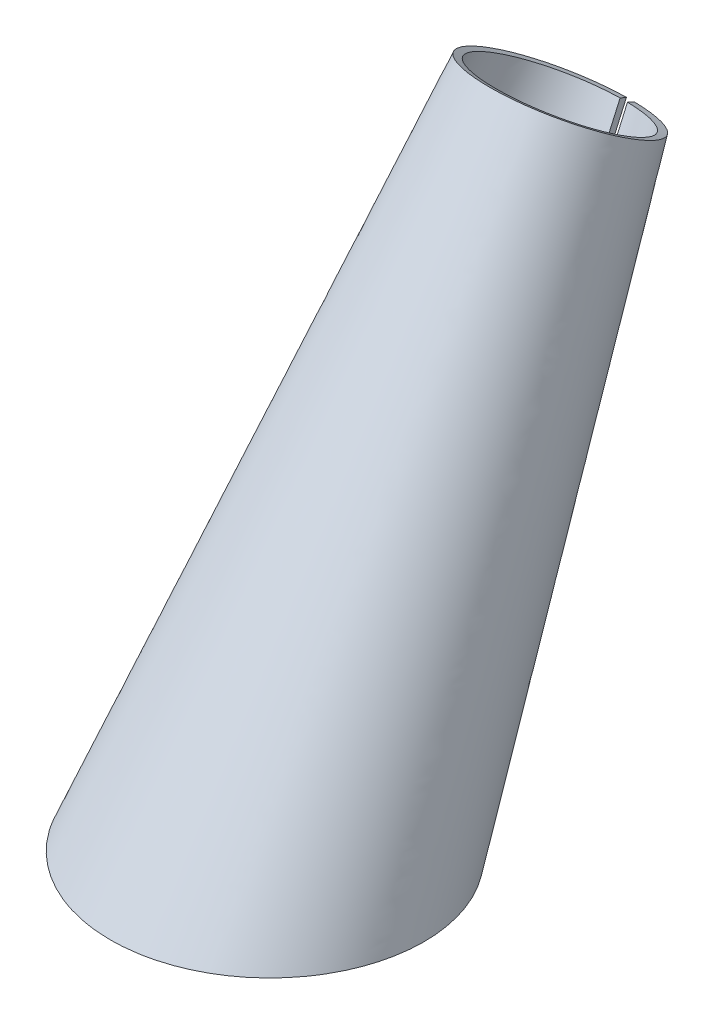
SolidWorks part; units mm, degrees
ref_plane "Ebene vorne" through (0, 0, 0) normal (0, 0, 1) x (1, 0, 0)
ref_plane "Ebene oben" through (0, 0, 0) normal (0, 1, 0) x (1, 0, 0)
ref_plane "Ebene rechts" through (0, 0, 0) normal (1, 0, 0) x (0, 0, -1)
sketch "Skizze1" plane through (0, 0, 0) normal (0, 1, 0) x (1, 0, 0)
  arc A0 (-2.5, 99.9687) -> (2.5, 99.9687) centre (0, 0) ccw
  arc A1 (2.5, 99.9687) -> (-2.5, 99.9687) centre (0, 0) ccw construction
  point P1 (0, 100)
  point P3 (-8.9081, 106.6148)
  point P4 (10.2292, 106.4962)
  point P6 (4.1118, 106.9073)
  dimension "D2" = 100
  dimension "D1" = 5
sketch "Skizze2" plane through (0, 0, 0) normal (1, 0, 0) x (0, 0, -1)
  line L0 (0, 0) -> (200, 346.4102) construction
  line L1 (0, 0) -> (0, 207.2655) construction
  dimension "D1" = 30
  dimension "D2" = 400
ref_plane "Ebene1" through (0, 346.4102, -200) normal (0, 0.866, -0.5) x (-1, 0, 0)
sketch "Skizze3" plane through (0, 346.4102, -200) normal (0, 0.866, -0.5) x (-1, 0, 0)
  arc A0 (-2.5, -49.9375) -> (2.5, -49.9375) centre (0, 0) ccw construction
  arc A1 (2.5, -49.9375) -> (-2.5, -49.9375) centre (0, 0) ccw
  point P1 (0, -50)
  point P3 (-6.8495, -67.238)
  point P4 (9.7456, -66.8797)
  point P6 (0, -76.4962)
  dimension "D2" = 50
  dimension "D1" = 5
sheet metal parameters "Blech1" thickness 5 parameters "D1"=20, "Dicke"=5
lofted bend "Ausgeformte Biegungen1" parameters "D1"=0, "D12"=5
other "Freiform-Biegung1" parameters "D1"=1000, "D4"=57.296, "D5"=1
flat pattern "Abwicklung1"
sketch "Biegung-Linien1" plane through (0, 0, 0) normal (0, 1, 0) x (-1, 0, 0)
other "Abwickeln-<Freiform-Biegung1>1"
